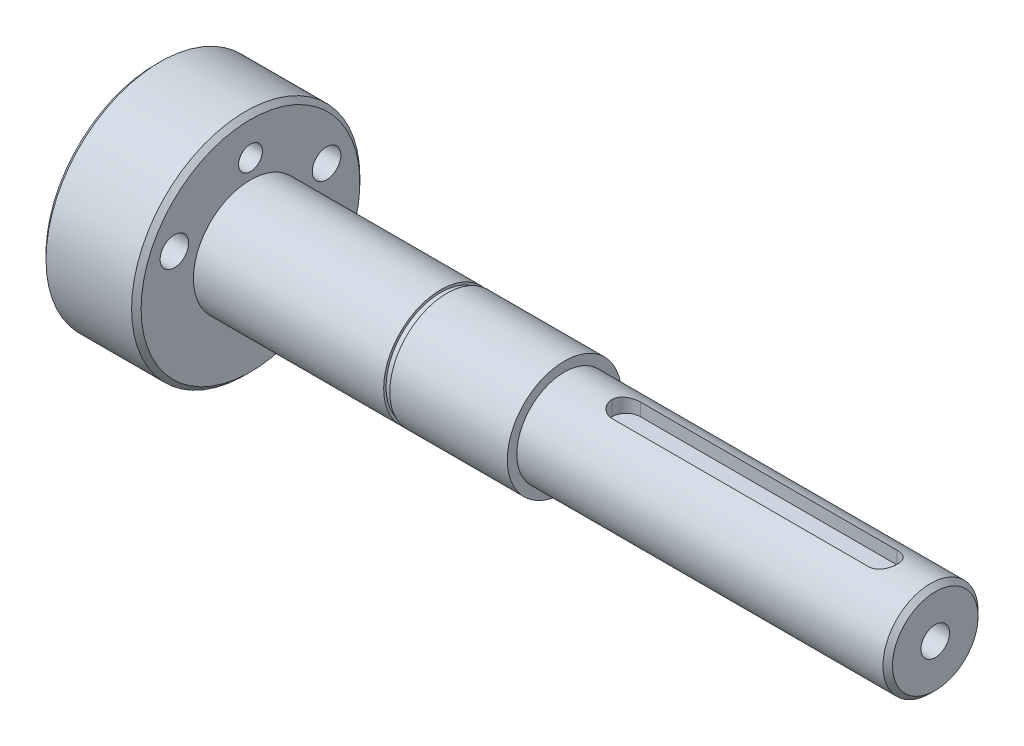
SolidWorks part; units mm, degrees
ref_plane "Plan1" through (0, 0, 0) normal (0, 0, 1) x (1, 0, 0)
ref_plane "Plan2" through (0, 0, 0) normal (0, 1, 0) x (1, 0, 0)
ref_plane "Plan3" through (0, 0, 0) normal (1, 0, 0) x (0, 0, -1)
sketch "Esquisse1" plane through (0, 0, 0) normal (0, 0, 1) x (1, 0, 0)
  line L0 (0, 0) -> (0, 24)
  line L1 (0, 24) -> (20, 24)
  line L2 (20, 24) -> (20, 12)
  line L3 (20, 12) -> (86, 12)
  line L4 (86, 12) -> (86, 10)
  line L5 (86, 10) -> (164, 10)
  line L6 (164, 10) -> (164, 0)
  line L7 (164, 0) -> (0, 0)
  line L8 (0, 0) -> (138.3219, 0) construction
  dimension "D1" = 20
  dimension "D2" = 66
  dimension "D3" = 78
  dimension "D4" = 24
  dimension "D5" = 12
  dimension "D6" = 10
revolve "Base-Révolution" add sketch "Esquisse1" angle 360 about L8
hole_wizard "Perçage1" positions "Esquisse4" profile "Esquisse3" tap size "M6x1.0" standard "ISO"
sketch "Esquisse4" plane through (164, 0, 0) normal (1, 0, 0) x (0, 0, -1)
  circle A0 centre (0, 0) radius 24 construction
  point P0 (0, 0)
sketch "Esquisse3" plane through (164, 0, 0) normal (0, 1, 0) x (0, 0, -1)
  line L0 (0, 0) -> (0, 18.5022)
  line L1 (0, 18.5022) -> (2.5, 17)
  line L2 (2.5, 17) -> (2.5, 12)
  line L3 (2.5, 12) -> (3, 12)
  line L4 (3, 12) -> (3, 0)
  line L5 (3, 0) -> (0, 0)
  line L10 (0, 18.5022) -> (-2.5, 17) construction
  line L11 (0, -6.35) -> (0, 107.95) construction
  dimension "Diamètre du trou pour taraudage" = 5
  dimension "Profondeur du trou pour taraudage" = 17
  dimension "Diamètre du filetage" = 6
  dimension "Profondeur du filetage" = 12
  dimension "Angle de pointe" = 118
sketch "Esquisse6" plane through (0, 0, 0) normal (0, 0, 1) x (1, 0, 0)
  line L0 (86, 12) -> (20, 12) construction
  line L1 (60, 11.5) -> (61.3, 11.5)
  line L2 (60, 11.5) -> (60, 12)
  line L3 (60, 12) -> (61.3, 12)
  line L4 (61.3, 11.5) -> (61.3, 12)
  line L5 (20, -24) -> (20, 24) construction
  line L6 (0, 0) -> (81.9089, 0) construction
  line L7 (152, 0) -> (164, 0) construction
  dimension "D1" = 1.3
  dimension "D2" = 0.5
  dimension "D3" = 40
revolve "Enlèvement de matière-Révolution1" cut sketch "Esquisse6" angle 360 about L6
sketch "Esquisse5" plane through (0, 0, 0) normal (0, 0, 1) x (1, 0, 0)
  line L1 (96, 6.8544) -> (156, 6.8544)
  line L2 (96, 6.8544) -> (96, 10)
  line L3 (96, 10) -> (156, 10)
  line L4 (156, 6.8544) -> (156, 10)
  line L6 (164, 10) -> (86, 10) construction
  line L7 (86, -12) -> (86, 12) construction
  dimension "D1" = 10
  dimension "D2" = 60
extrude "Enlèv. mat.-Extru.1" cut sketch "Esquisse5" against normal mid plane 6
fillet "Congé1" radius 3
chamfer "Chanfrein1" distance 1 angle 45
sketch "Esquisse7" plane through (0, 0, 0) normal (-1, 0, 0) x (0, 0, 1)
  circle A0 centre (-16, 7) radius 3
  circle A1 centre (16, 7) radius 3
  circle A2 centre (0, 16) radius 2.5
  circle A3 centre (0, 0) radius 24 construction
  dimension "D1" = 6
  dimension "D2" = 6
  dimension "D3" = 16
  dimension "D4" = 32
  dimension "D5" = 7
  dimension "D6" = 7
  dimension "D7" = 5
  dimension "D8" = 16
extrude "Enlèv. mat.-Extru.2" cut sketch "Esquisse7" against normal through all
